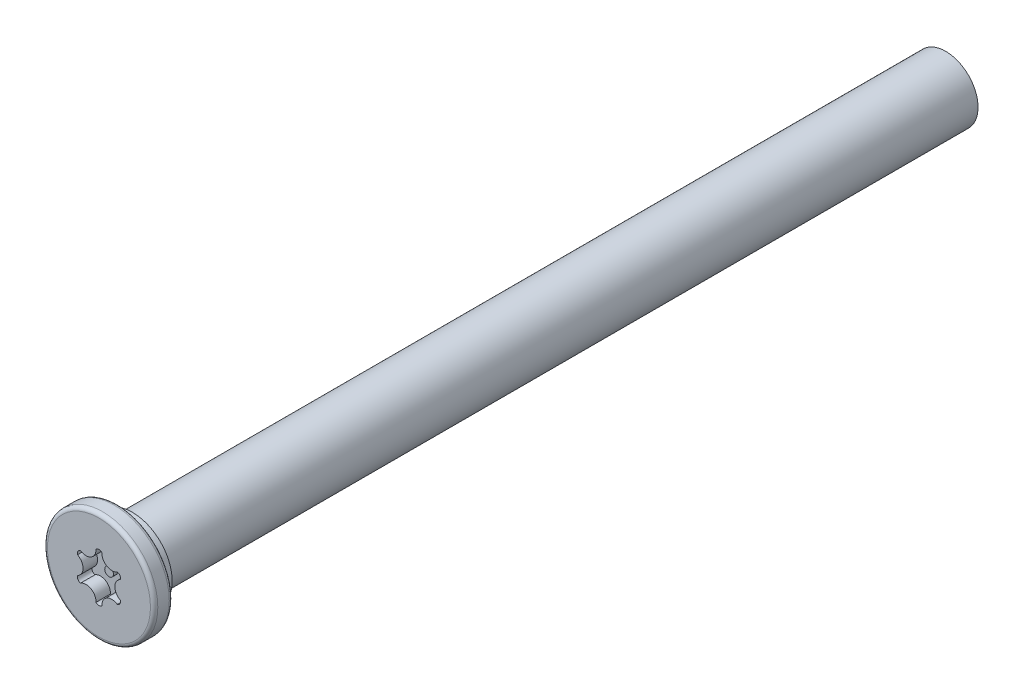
SolidWorks part; units mm, degrees
ref_plane "Front Plane" through (0, 0, 0) normal (0, 0, 1) x (1, 0, 0)
ref_plane "Top Plane" through (0, 0, 0) normal (0, 1, 0) x (1, 0, 0)
ref_plane "Right Plane" through (0, 0, 0) normal (1, 0, 0) x (0, 0, -1)
sketch "Sketch2" plane through (0, 0, 0) normal (1, 0, 0) x (0, 0, -1)
  line L1 (0, 0) -> (1.3, 0)
  line L2 (0, 0) -> (0, 3.81)
  line L3 (0, 3.81) -> (1.3, 3.81)
  line L4 (1.3, 0) -> (1.3, 3.81)
  line L5 (1.3, 0) -> (14, 0)
  line L6 (1.3, 0) -> (1.3, 2.23)
  line L7 (1.3, 2.23) -> (14, 2.23)
  line L8 (14, 0) -> (14, 2.23)
  dimension "D1" = 3.81
  dimension "D2" = 1.3
  dimension "D3" = 12.7
  dimension "D4" = 2.23
revolve "Revolve1" add sketch "Sketch2" angle 360 about L5
sketch "Sketch3" plane through (0, 0, 0) normal (0, 0, 1) x (1, 0, 0)
  line L0 (0, 1.3843) -> (0, 0)
  line L3 (1.1845, -1.0048) -> (2.4257, -1.0048)
  line L4 (0, 1.675) -> (0, 1.6727)
  line L5 (0, 1.675) -> (0, 1.6727)
  line L6 (0, 1.6727) -> (0, 1.675)
  line L8 (1.0407, 1.8026) -> (1.1012, 1.9073)
  line L9 (1.3857, 1.205) -> (2.5818, 1.205)
  line L10 (0, 0) -> (0.8375, 1.4506)
  line L11 (0, 0) -> (2.5818, 0)
  line L14 (2.5818, 0) -> (2.5818, 1.205)
  line L15 (1.3857, 1.205) -> (-0.1691, 1.205)
  circle A0 centre (0, 0) radius 1.675
  arc A7 (1.1845, -1.0048) -> (1.0345, -1.0748) centre (0.8546, -0.4934) cw
  arc A16 (-0.2051, 1.5894) -> (0.2051, 1.5894) centre (0, 1.3843) cw
  arc A18 (0.2051, 1.5894) -> (1.2739, 0.9723) centre (0.8938, 1.5482) ccw
  arc A19 (1.479, 0.6171) -> (1.479, -0.6171) centre (1.7877, 0) ccw
  arc A20 (1.2739, 0.9723) -> (1.479, 0.6171) centre (1.1988, 0.6922) cw
  arc A21 (1.2739, -0.9723) -> (0.2051, -1.5894) centre (0.8938, -1.5482) ccw
  arc A22 (1.479, -0.6171) -> (1.2739, -0.9723) centre (1.1988, -0.6922) cw
  arc A23 (-0.2051, -1.5894) -> (-1.2739, -0.9723) centre (-0.8938, -1.5482) ccw
  arc A24 (0.2051, -1.5894) -> (-0.2051, -1.5894) centre (0, -1.3843) cw
  arc A25 (-1.479, -0.6171) -> (-1.479, 0.6171) centre (-1.7877, 0) ccw
  arc A26 (-1.2739, -0.9723) -> (-1.479, -0.6171) centre (-1.1988, -0.6922) cw
  arc A27 (-1.2739, 0.9723) -> (-0.2051, 1.5894) centre (-0.8938, 1.5482) ccw
  arc A28 (-1.479, 0.6171) -> (-1.2739, 0.9723) centre (-1.1988, 0.6922) cw
  point P38 (0, 0)
  point P52 (0, 0)
  dimension "D1" = 3.35
  dimension "D4" = 1.205
  dimension "D2" = 6
  dimension "D5" = 60
extrude "Cut-Extrude3" cut sketch "Sketch3" against normal blind 1
fillet "Fillet12" radius 0.254 2 edges at (3.81, 0, 0) (3.81, 0, -1.3)
sketch "Sketch7" plane through (0, 0, -14) normal (0, 0, -1) x (-1, 0, 0)
  circle A0 centre (0, 0) radius 2.23
  dimension "D1" = 4.46
extrude "Cut-Extrude6" cut sketch "Sketch7" against normal blind 12.7
sketch "Sketch11" plane through (0, 0, -1.3) normal (0, 0, -1) x (-1, 0, 0)
  circle A0 centre (0, 0) radius 2.23
  circle A1 centre (0, 0) radius 2.738
extrude "Boss-Extrude1" add sketch "Sketch11" along normal blind 1.016
sketch "Sketch12" plane through (0, 0, -1.3) normal (0, 0, -1) x (-1, 0, 0)
  circle A0 centre (0, 0) radius 2.23
extrude "Boss-Extrude2" add sketch "Sketch12" along normal blind 12.7
sketch "Sketch14" plane through (0, 0, -1) normal (0, 0, 1) x (1, 0, 0)
  circle A0 centre (0, 0) radius 0.3
extrude "Boss-Extrude4" add sketch "Sketch14" along normal blind 0.3
sketch "Sketch15" plane through (0, 0, -14) normal (0, 0, -1) x (-1, 0, 0)
  circle A0 centre (0, 0) radius 2.23
extrude "Cut-Extrude7" cut sketch "Sketch15" against normal blind 12.7
sketch "Sketch16" plane through (0, 0, -1.3) normal (0, 0, -1) x (-1, 0, 0)
  circle A0 centre (0, 0) radius 2.23
extrude "Boss-Extrude5" add sketch "Sketch16" along normal blind 57.15
